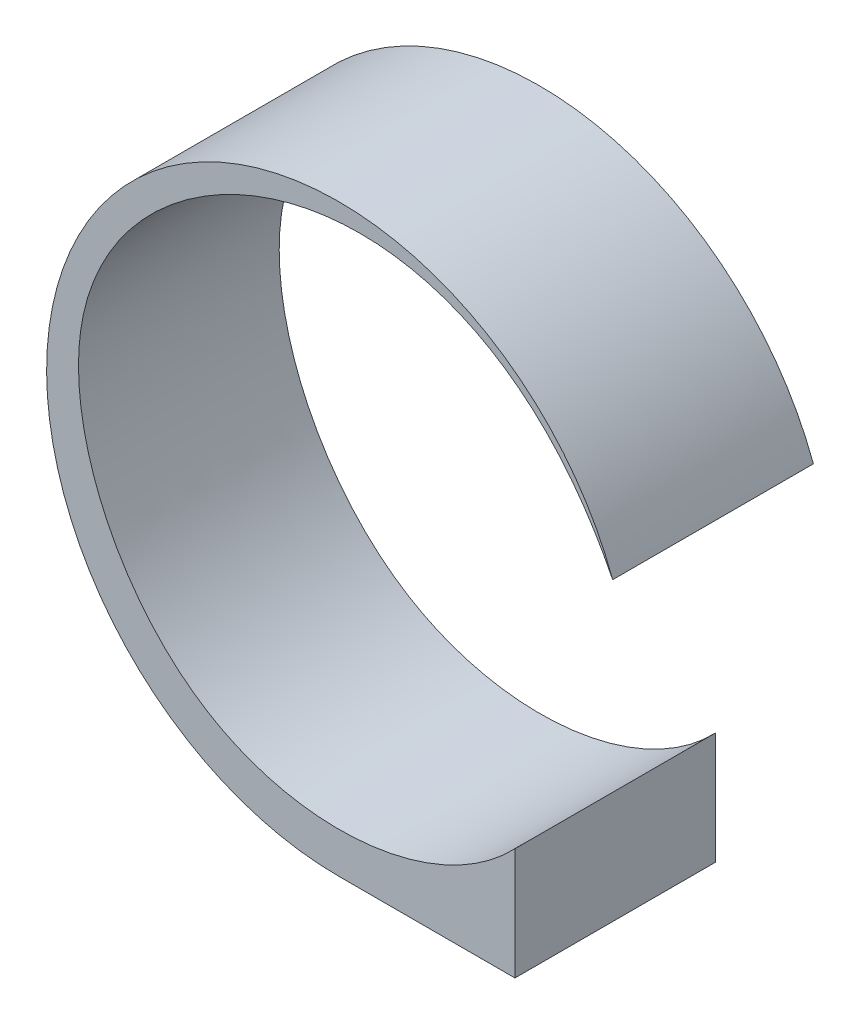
SolidWorks part; units mm, degrees
ref_plane "Front Plane" through (0, 0, 0) normal (0, 0, 1) x (1, 0, 0)
ref_plane "Top Plane" through (0, 0, 0) normal (0, 1, 0) x (1, 0, 0)
ref_plane "Right Plane" through (0, 0, 0) normal (1, 0, 0) x (0, 0, -1)
sketch "Sketch1" plane through (0, 0, 0) normal (0, 0, 1) x (1, 0, 0)
  line L0 (31.75, 13.5255) -> (41.783, 13.5255)
  line L2 (41.783, 19.9014) -> (41.783, 13.5255)
  line L3 (31.75, 13.5255) -> (45.085, 13.5255) construction
  line L4 (22.4282, 0) -> (22.4282, 60.325) construction
  arc A0 (48.387, 30.1625) -> (31.75, 13.5255) centre (31.75, 30.1625) ccw construction
  arc A1 (47.3479, 35.95) -> (31.75, 13.5255) centre (31.75, 30.1625) ccw
  circle A2 centre (31.75, 30.1625) radius 14.351 construction
  spline S0 degree 3 poles (41.783, 19.9014) (37.3884, 15.3005) (22.5097, 13.8279) (9.7671, 41.8096) (38.9104, 52.8969) (47.3479, 35.95) knots 0 0 0 0 0.262421 0.499518 1 1 1 1
  point P8 (31.75, 45.7941)
  point P11 (18.341, 24.9149)
  dimension "D1" = 28.702
  dimension "D2" = 10.033
extrude "Boss-Extrude1" add sketch "Sketch1" along normal up to surface (11.43 mm away)
